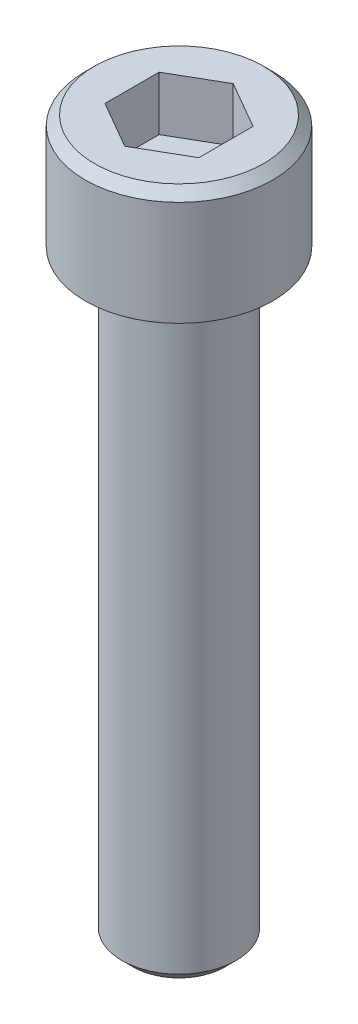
SolidWorks part; units mm, degrees
ref_plane "Front" through (0, 0, 0) normal (0, 0, 1) x (1, 0, 0)
ref_plane "Top" through (0, 0, 0) normal (0, 1, 0) x (1, 0, 0)
ref_plane "Right" through (0, 0, 0) normal (1, 0, 0) x (0, 0, -1)
sketch "Sketch1" plane through (0, 0, 0) normal (0, 0, 1) x (1, 0, 0)
  line L0 (0, 0) -> (3.9688, 0)
  line L1 (3.9688, 0) -> (3.9688, 4.4291)
  line L2 (3.9688, 4.4291) -> (3.5719, 4.826)
  line L3 (3.5719, 4.826) -> (0, 4.826)
  line L4 (0, 4.826) -> (0, 0)
  line L5 (0, 0) -> (0, 100) construction
revolve "Base-Revolve" add sketch "Sketch1" angle 360 about L5
sketch "Sketch2" plane through (0, 0, 0) normal (0, 0, 1) x (1, 0, 0)
  line L0 (0, 0) -> (0, 100) construction
  line L1 (0, -25.4) -> (1.9406, -25.4)
  line L2 (1.9406, -25.4) -> (2.413, -24.9276)
  line L3 (2.413, -24.9276) -> (2.413, 0)
  line L4 (2.413, 0) -> (0, 0)
  line L5 (0, 0) -> (0, -25.4)
revolve "Boss-Revolve1" add sketch "Sketch2" angle 360 about L0
ref_plane "Plane4" through (0, 4.826, 0) normal (0, 1, 0) x (-1, 0, 0)
sketch "Sketch3" plane through (0, 4.826, 0) normal (0, 1, 0) x (-1, 0, 0)
  line L0 (1.985, 1.146) -> (0, 2.2921)
  line L1 (0, 2.2921) -> (-1.985, 1.146)
  line L2 (-1.985, 1.146) -> (-1.985, -1.146)
  line L3 (-1.985, -1.146) -> (0, -2.2921)
  line L4 (0, -2.2921) -> (1.985, -1.146)
  line L5 (1.985, -1.146) -> (1.985, 1.146)
extrude "Cut-Extrude1" cut sketch "Sketch3" against normal blind 2.286
